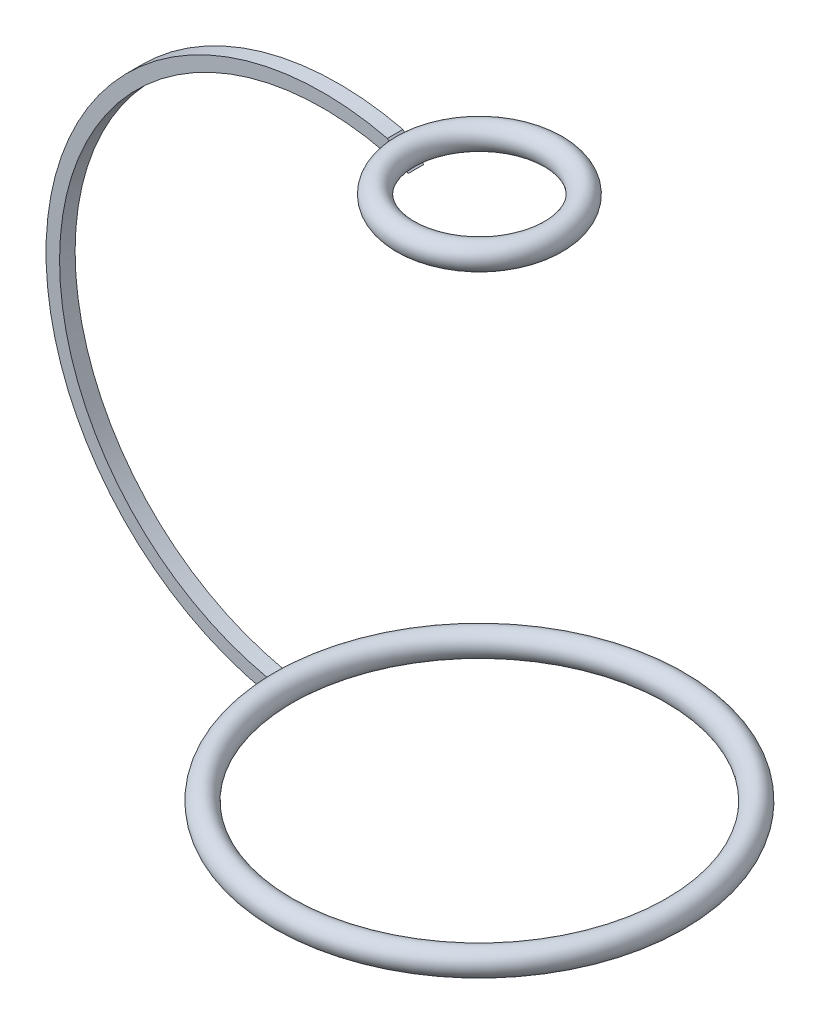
SolidWorks part; units mm, degrees
ref_plane "Face" through (0, 0, 0) normal (0, 0, 1) x (1, 0, 0)
ref_plane "Dessus" through (0, 0, 0) normal (0, 1, 0) x (1, 0, 0)
ref_plane "Côté" through (0, 0, 0) normal (1, 0, 0) x (0, 0, -1)
sketch "Esquisse2" plane through (0, 0, 0) normal (0, 0, 1) x (1, 0, 0)
  line L0 (0, -3.252) -> (0, 21.4089) construction
  circle A0 centre (-4.75, 0.8) radius 0.8
  dimension "D1" = 1.6
  dimension "D2" = 0.8
  dimension "D3" = 9.5
revolve "Base-Révolution" add sketch "Esquisse2" angle 360 about L0
sketch "Esquisse3" plane through (0, 0, 0) normal (0, 0, 1) x (1, 0, 0)
  line L0 (-5.4179, 1.446) -> (-4.0821, 0.154)
  line L1 (-11.8632, -32.6885) -> (-13.3368, -33.3115)
  arc A0 (-5.4179, 1.446) -> (-13.3368, -33.3115) centre (-9.5572, -15.8918) ccw
  arc A1 (-4.0821, 0.154) -> (-11.8632, -32.6885) centre (-9.5572, -15.8918) ccw
  circle A2 centre (-12.6, -33) radius 0.8 construction
  circle A3 centre (-4.75, 0.8) radius 0.8 construction
  dimension "D2" = 1.6
  dimension "D5" = 1.6
  dimension "D6" = 0.8
  dimension "D3" = 33
  dimension "D4" = 12.6
  dimension "D7" = 4.75
extrude "Boss.-Extru.1" add sketch "Esquisse3" along normal mid plane 1
sketch "Esquisse4" plane through (0, 0, 0) normal (0, 0, 1) x (1, 0, 0)
  line L0 (0, 2.8543) -> (0, -23.041) construction
  line L1 (0, -3.252) -> (0, 21.4089) construction
  circle A0 centre (-12.6, -33) radius 0.8
  dimension "D1" = 1.6
  dimension "D2" = 25.2
  dimension "D3" = 33
revolve "Boss.-Révol.1" add sketch "Esquisse4" angle 360 about L0
